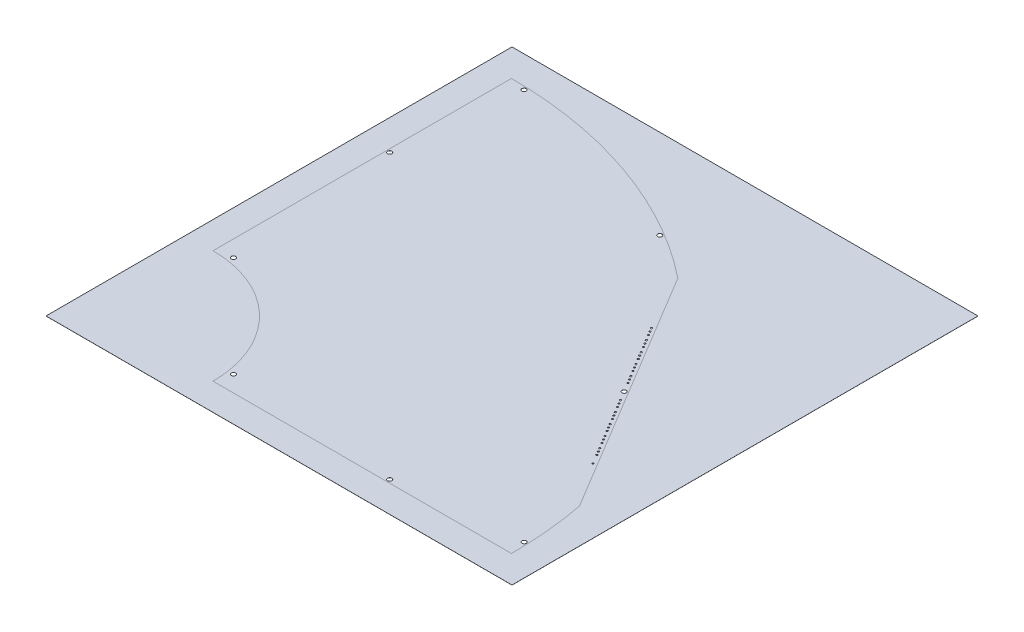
SolidWorks part; units mm, degrees
ref_plane "Front Plane" through (0, 0, 0) normal (0, 0, 1) x (1, 0, 0)
ref_plane "Top Plane" through (0, 0, 0) normal (0, 1, 0) x (1, 0, 0)
ref_plane "Right Plane" through (0, 0, 0) normal (1, 0, 0) x (0, 0, -1)
sketch "Sketch1" plane through (0, 0, 0) normal (0, 1, 0) x (1, 0, 0)
  line B0 (374.5533, 69.7912) -> (237.4641, 297.9459)
  line B1 (0.5, 104.9988) -> (0.5, 380.9997)
  line B2 (104.9988, 0.5) -> (380.9997, 0.5)
  arc B3 (374.5533, 69.7912) -> (380.9997, 0.5) centre (0, 0) cw
  arc B4 (0.5, 380.9997) -> (237.4641, 297.9459) centre (0, 0) cw
  arc B5 (0.5, 104.9988) -> (104.9988, 0.5) centre (0, 0) cw
  circle B6 centre (15.5, 377.6821) radius 2
  circle B7 centre (194.6844, 324.0092) radius 2
  circle B8 centre (15.5, 108.9025) radius 2
  circle B9 centre (303.4372, 182.3235) radius 2
  circle B10 centre (108.9025, 15.5) radius 2
  circle B11 centre (377.6821, 15.5) radius 2
  circle B12 centre (265.4069, 3.5) radius 2
  circle B13 centre (3.5, 265.4069) radius 2
sketch_block_instance "Quadrant Outer Profile with Gap-1"
sketch_block "Quadrant Outer Profile with Gap" parameters "D2"=381, "D3"=105, "D1"=31, "D4"=16, "D5"=357
sketch_block_instance "Hole Pin Locations-1"
sketch_block "Hole Pin Locations" parameters "D1"=4, "D10"=378, "D11"=110, "D2"=31, "D3"=3.5, "D4"=15.5, "D5"=15.5, "D6"=15.5, "D7"=3.5, "D8"=15.5, "D9"=354, "D12"=59, "D13"=265.43, "D14"=265.43, "D15"=16
extrude "Extrude1" add sketch "Sketch1" along normal blind 0.06
sketch "Sketch2" plane through (0, 0, 0) normal (0, -1, 0) x (1, 0, 0)
  line L0 (374.5533, -69.7912) -> (237.4641, -297.9459) construction
  circle B0 centre (298.2868, -190.8952) radius 0.75
  circle B1 centre (291.0763, -202.8955) radius 0.75
  circle B2 centre (289.0162, -206.3242) radius 0.75
  circle B3 centre (296.2267, -194.3238) radius 0.75
  circle B4 centre (294.1665, -197.7525) radius 0.75
  circle B5 centre (286.956, -209.7528) radius 0.75
  circle B6 centre (283.8658, -214.8958) radius 0.75
  circle B7 centre (281.8056, -218.3245) radius 0.75
  circle B8 centre (279.7455, -221.7532) radius 0.75
  circle B9 centre (276.6552, -226.8962) radius 0.75
  circle B10 centre (274.5951, -230.3248) radius 0.75
  circle B11 centre (272.5349, -233.7535) radius 0.75
  circle B12 centre (269.4447, -238.8965) radius 0.75
  circle B13 centre (267.3846, -242.3252) radius 0.75
  circle B14 centre (265.3244, -245.7539) radius 0.75
  circle B15 centre (341.55, -118.8931) radius 0.75
  circle B16 centre (339.4899, -122.3218) radius 0.75
  circle B17 centre (337.4297, -125.7504) radius 0.75
  circle B18 centre (334.3395, -130.8934) radius 0.75
  circle B19 centre (332.2794, -134.3221) radius 0.75
  circle B20 centre (330.2192, -137.7508) radius 0.75
  circle B21 centre (327.129, -142.8938) radius 0.75
  circle B22 centre (325.0688, -146.3225) radius 0.75
  circle B23 centre (323.0087, -149.7511) radius 0.75
  circle B24 centre (319.9184, -154.8941) radius 0.75
  circle B25 centre (312.7079, -166.8945) radius 0.75
  circle B26 centre (310.6478, -170.3231) radius 0.75
  circle B27 centre (317.8583, -158.3228) radius 0.75
  circle B28 centre (315.7981, -161.7515) radius 0.75
  circle B29 centre (308.5876, -173.7518) radius 0.75
  circle B30 centre (346.7004, -110.3214) radius 0.75
sketch_block_instance "SIMM Pin Locations-1"
sketch_block "SIMM Pin Locations" parameters "D4"=1.5, "D5"=1.5, "D1"=31, "D2"=354, "D3"=10, "D6"=84
extrude "Extrude2" cut sketch "Sketch2" against normal through all
sketch "Sketch3" plane through (0, 0, 0) normal (0, 1, 0) x (1, 0, 0)
  line L0 (104.9988, 0.5) -> (380.9997, 0.5) construction
  line L1 (374.5533, 69.7912) -> (237.4641, 297.9459) construction
  line L2 (0.5, 380.9997) -> (0.5, 104.9988) construction
  line L3 (104.9988, 0.5) -> (380.9997, 0.5)
  line L4 (374.5533, 69.7912) -> (237.4641, 297.9459)
  line L5 (0.5, 380.9997) -> (0.5, 104.9988)
  line L7 (-24.5, -24.5) -> (406.5, -24.5)
  line L8 (-24.5, -24.5) -> (-24.5, 406.5)
  line L9 (-24.5, 406.5) -> (406.5, 406.5)
  line L10 (406.5, -24.5) -> (406.5, 406.5)
  arc A0 (104.9988, 0.5) -> (0.5, 104.9988) centre (0, 0) ccw construction
  arc A1 (104.9988, 0.5) -> (0.5, 104.9988) centre (0, 0) ccw
  arc A2 (380.9997, 0.5) -> (374.5533, 69.7912) centre (0, 0) ccw construction
  arc A3 (237.4641, 297.9459) -> (0.5, 380.9997) centre (0, 0) ccw construction
  arc A4 (380.9997, 0.5) -> (374.5533, 69.7912) centre (0, 0) ccw
  arc A5 (237.4641, 297.9459) -> (0.5, 380.9997) centre (0, 0) ccw
  dimension "D1" = 431
  dimension "D2" = 431
  dimension "D3" = 25
  dimension "D4" = 25
extrude "Extrude5" add sketch "Sketch3" against normal up to surface (0.06 mm away) separate body
